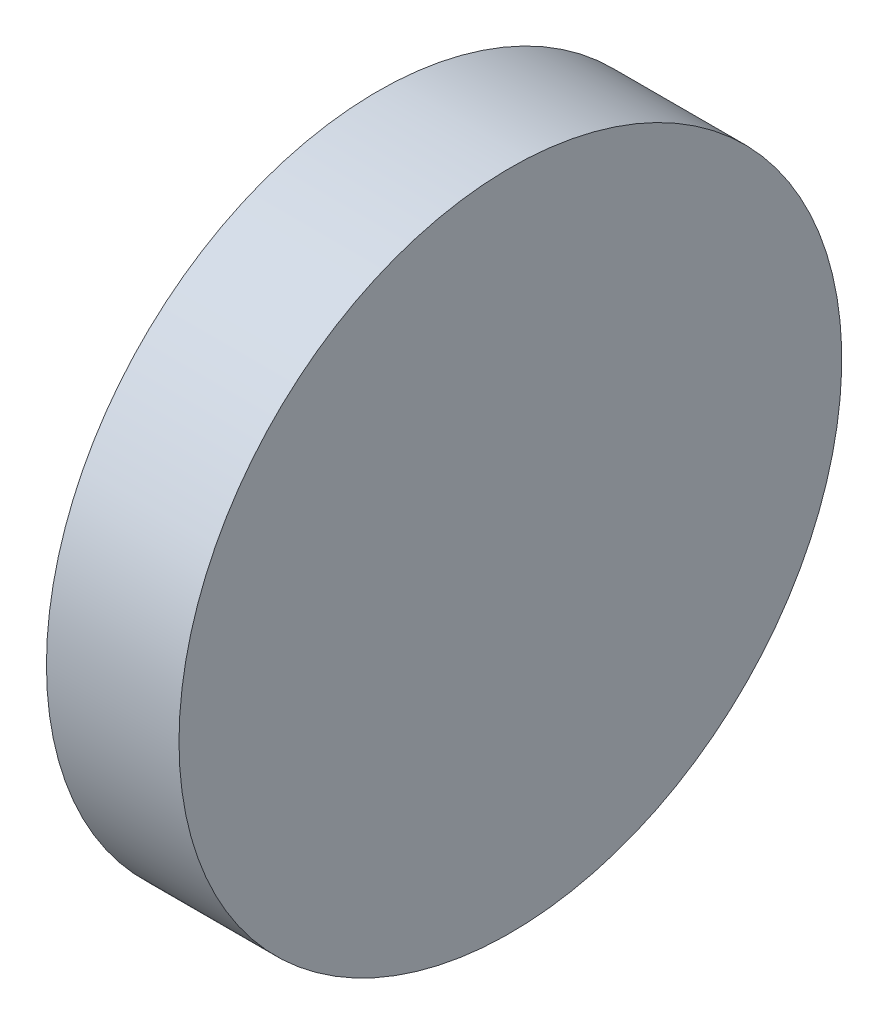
SolidWorks part; units mm, degrees
ref_plane "Vorne" through (0, 0, 0) normal (0, 0, 1) x (1, 0, 0)
ref_plane "Oben" through (0, 0, 0) normal (0, 1, 0) x (1, 0, 0)
ref_plane "Rechts" through (0, 0, 0) normal (1, 0, 0) x (0, 0, -1)
sketch "Skizze1" plane through (0, 0, 0) normal (0, 0, 1) x (1, 0, 0)
  line L0 (5, 0) -> (16.4147, 0) construction
  line L1 (0, 0) -> (5, 0)
  line L2 (0, 0) -> (0, 12.5)
  line L3 (0, 12.5) -> (5, 12.5)
  line L4 (5, 0) -> (5, 12.5)
  dimension "D1" = 12.5
  dimension "D2" = 5
revolve "Rotation1" add sketch "Skizze1" angle 360 about L0
